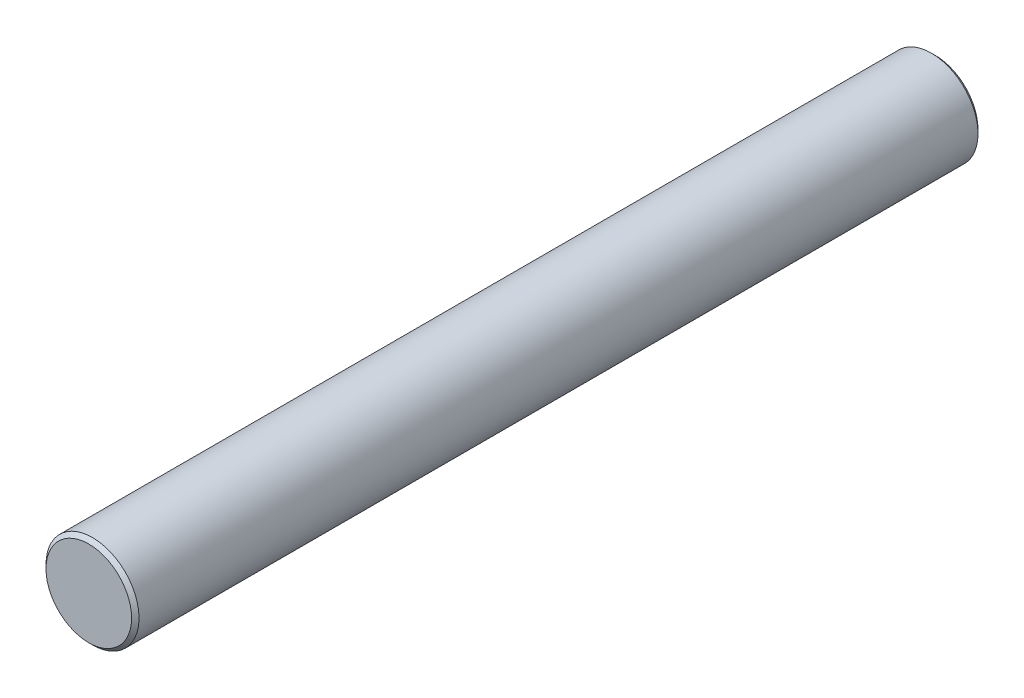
SolidWorks part; units mm, degrees
ref_plane "前视基准面" through (0, 0, 0) normal (0, 0, 1) x (1, 0, 0)
ref_plane "上视基准面" through (0, 0, 0) normal (0, 1, 0) x (1, 0, 0)
ref_plane "右视基准面" through (0, 0, 0) normal (1, 0, 0) x (0, 0, -1)
sketch "草图1" plane through (0, 0, 0) normal (0, 0, 1) x (1, 0, 0)
  circle A0 centre (0, 0) radius 25
extrude "凸台-拉伸1" add sketch "草图1" along normal blind 455
hole_wizard "M16 螺纹孔1" positions "草图2" profile "草图3" tap size "M16" standard "ISO"
sketch "草图2" plane through (0, 0, 0) normal (0, 0, -1) x (-1, 0, 0)
  point P0 (0, 0)
sketch "草图3" plane through (0, 0, 0) normal (1, 0, 0) x (0, 1, 0)
  line L0 (0, 0) -> (0, 42.206)
  line L1 (0, 42.206) -> (7, 38)
  line L2 (7, 38) -> (7, 0)
  line L5 (7, 0) -> (0, 0)
  line L10 (0, 42.206) -> (-7, 38) construction
  line L11 (0, -6.35) -> (0, 107.95) construction
  dimension "螺纹孔钻头直径" = 14
  dimension "螺纹孔钻头深度" = 38
  dimension "导头角度" = 118
chamfer "倒角1" distance 2 angle 45 2 edges at (25, 0, 455) (25, 0, 0)
